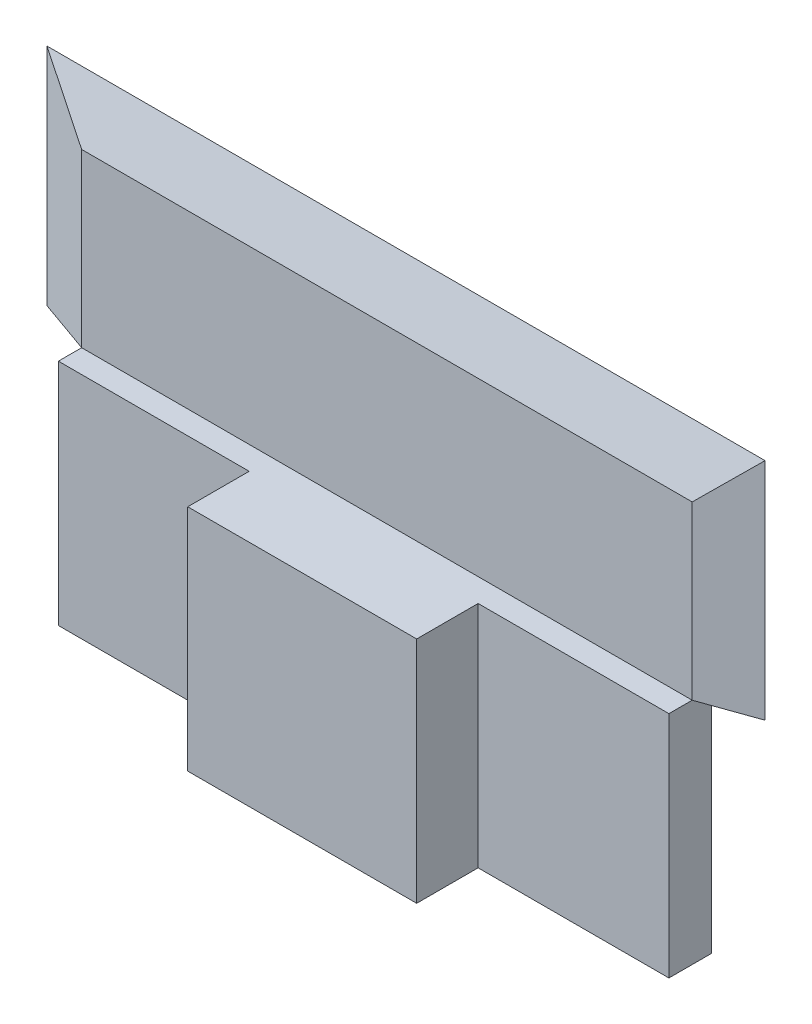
SolidWorks part; units mm, degrees
ref_plane "Front Plane" through (0, 0, 0) normal (0, 0, 1) x (1, 0, 0)
ref_plane "Top Plane" through (0, 0, 0) normal (0, 1, 0) x (1, 0, 0)
ref_plane "Right Plane" through (0, 0, 0) normal (1, 0, 0) x (0, 0, -1)
sketch "Sketch1" plane through (0, 0, 0) normal (0, 0, 1) x (1, 0, 0)
  line L1 (0, 0) -> (81.28, 0)
  line L2 (0, 0) -> (0, 60.96)
  line L3 (0, 60.96) -> (81.28, 60.96)
  line L4 (81.28, 0) -> (81.28, 60.96)
  dimension "D1" = 81.28
  dimension "D2" = 60.96
extrude "Boss-Extrude1" add sketch "Sketch1" along normal blind 11.2776
sketch "Sketch2" plane through (0, 0, 11.2776) normal (0, 0, 1) x (1, 0, 0)
  line L0 (0, 0) -> (81.28, 0) construction
  line L1 (0, 60.96) -> (30.48, 60.96)
  line L2 (0, 60.96) -> (0, 0)
  line L3 (0, 0) -> (30.48, 0)
  line L4 (30.48, 60.96) -> (30.48, 0)
extrude "Boss-Extrude2" add sketch "Sketch2" along normal blind 16.3576
sketch "Sketch3" plane through (0, 0, 0) normal (0, 0, -1) x (-1, 0, 0)
  line L1 (0, 60.96) -> (-95.6056, 60.96)
  line L2 (0, 60.96) -> (0, 120.8278)
  line L3 (0, 120.8278) -> (-95.6056, 120.8278)
  line L4 (-95.6056, 60.96) -> (-95.6056, 120.8278)
  dimension "D1" = 95.6056
  dimension "D2" = 59.8678
ref_plane "Plane1" through (0, 0, 5.08) normal (0, 0, 1) x (1, 0, 0)
sketch "Sketch4" plane through (0, 0, 5.08) normal (0, 0, 1) x (1, 0, 0)
  line L1 (0, 60.96) -> (81.28, 60.96)
  line L2 (0, 60.96) -> (0, 106.68)
  line L3 (0, 106.68) -> (81.28, 106.68)
  line L4 (81.28, 60.96) -> (81.28, 106.68)
  dimension "D1" = 81.28
  dimension "D2" = 45.72
loft "Loft4" add profiles "Sketch4", "Sketch3"
mirror "Mirror2" about plane through (0, 0, 11.2776) normal (1, 0, 0) of "Loft4", "Boss-Extrude2", "Boss-Extrude1"
equation "\"D1@Sketch2\"=48/2*1.27"
equation "\"D1@Boss-Extrude2\"=12.88*1.27"
